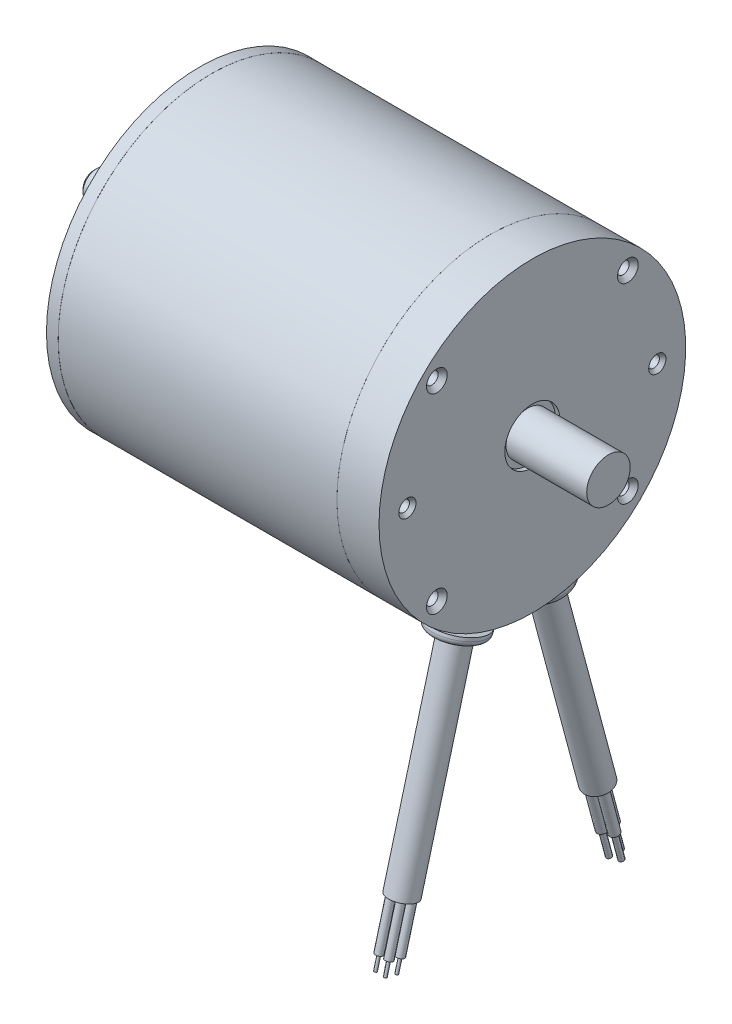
SolidWorks part; units mm, degrees
ref_plane "Front Plane" through (0, 0, 0) normal (0, 0, 1) x (1, 0, 0)
ref_plane "Top Plane" through (0, 0, 0) normal (0, 1, 0) x (1, 0, 0)
ref_plane "Right Plane" through (0, 0, 0) normal (1, 0, 0) x (0, 0, -1)
sketch "Sketch1" plane through (0, 0, 0) normal (0, 0, 1) x (1, 0, 0)
  line L0 (0, 0) -> (138.9109, 0) construction
  line L1 (0, 0) -> (0, 2.5)
  line L2 (0, 2.5) -> (21.12, 2.5)
  line L3 (21.12, 2.5) -> (21.12, 11.006)
  line L4 (21.12, 11.006) -> (20.92, 11.006)
  line L5 (20.92, 11.006) -> (20.92, 9.4)
  line L6 (20.92, 9.4) -> (17.5, 9.4)
  line L7 (17.5, 9.4) -> (17.5, 12.5)
  line L8 (17.5, 12.5) -> (19.5, 12.5)
  line L9 (19.5, 12.5) -> (19.5, 28.22)
  line L10 (19.5, 28.22) -> (80.7, 28.22)
  line L11 (80.7, 28.22) -> (80.7, 5.08)
  line L12 (80.7, 5.08) -> (79.86, 5.08)
  line L13 (79.86, 5.08) -> (79.86, 4)
  line L14 (94.7, 0) -> (0, 0)
  line L15 (79.86, 4) -> (94.7, 4)
  line L16 (94.7, 4) -> (94.7, 0)
  dimension "D2" = 25
  dimension "D3" = 18.8
  dimension "D4" = 2
  dimension "D5" = 22.012
  dimension "D6" = 5
  dimension "D7" = 21.12
  dimension "D8" = 56.44
  dimension "D9" = 19.5
  dimension "D11" = 0.2
  dimension "LENGTH" = 61.2
  dimension "D12" = 8
  dimension "D13" = 14
  dimension "D14" = 10.16
  dimension "D15" = 14.84
revolve "Revolve1" add sketch "Sketch1" angle 360 about L0
chamfer "Chamfer1" distance 0.508 angle 45 1 edges at (0, 0, 2.5)
fillet "Fillet1" radius 0.25 1 edges at (17.5, 0, 12.5)
fillet "Fillet2" radius 0.13 1 edges at (17.5, 0, 9.4)
sketch "Sketch2" plane through (0, 0, 0) normal (0, 0, 1) x (1, 0, 0)
  line L0 (80.7, 28.22) -> (19.5, 28.22) construction
  line L2 (72.9465, 28.22) -> (72.9535, 28.22)
  line L3 (19.5, 28.22) -> (19.5, -28.22) construction
  line L4 (21.6638, 28.22) -> (21.66, 28.2138)
  line L5 (21.66, 28.2138) -> (21.6568, 28.22)
  line L6 (72.9535, 28.22) -> (72.95, 28.2139)
  line L7 (72.95, 28.2139) -> (72.9465, 28.22)
  line L8 (21.6638, 28.22) -> (21.6568, 28.22)
  line L9 (80.7, -28.22) -> (80.7, 28.22) construction
  dimension "D1" = 0.007
  dimension "D2" = 2.16
  dimension "D3" = 28.2138
  dimension "D4" = 0.007
  dimension "D5" = 7.75
revolve "Cut-Revolve1" cut sketch "Sketch2" angle 360 about axis through (0, 0, 0) along (-1, 0, 0)
sketch "Sketch25" plane through (0, 0, 0) normal (0, 0, 1) x (1, 0, 0)
  line L0 (21.12, 11.006) -> (21.12, -11.006) construction
  line L1 (21.12, 6.5772) -> (21.12, 5.8868)
  line L2 (20.92, 9.3646) -> (21.4467, 9.3646)
  line L3 (20.92, -11.006) -> (20.92, 11.006) construction
  line L4 (21.4467, 9.3646) -> (21.4467, 6.904)
  line L5 (21.4467, 6.904) -> (21.12, 6.5772)
  line L6 (21.12, 5.8868) -> (21.4467, 5.56)
  line L7 (21.4467, 5.56) -> (21.4467, 2.7378)
  line L8 (20.92, 2.5) -> (22.9293, 2.5) construction
  line L9 (21.12, 2.5) -> (0.508, 2.5) construction
  line L10 (21.4467, 2.7378) -> (22.7362, 2.7378)
  line L11 (22.7362, 2.7378) -> (22.7362, 2.5)
  line L12 (22.7362, 2.5) -> (20.92, 2.5)
  line L13 (20.92, 2.5) -> (20.92, 9.3646)
  dimension "D1" = 2.7378
  dimension "D2" = 6.8646
  dimension "D3" = 0.5267
  dimension "D4" = 1.2895
  dimension "D5" = 3.149
  dimension "D6" = 45
  dimension "D7" = 2.7874
  dimension "D8" = 45
revolve "Cut-Revolve2" cut sketch "Sketch25" angle 360 about axis through (0, 0, 0) along (-1, 0, 0)
sketch "Sketch10" plane through (80.7, 0, 0) normal (1, 0, 0) x (0, 0, -1)
  line L0 (0, 0) -> (-23, 0) construction
  line L1 (0, 0) -> (-17.5751, 17.5751) construction
  circle A0 centre (0, 0) radius 24.855 construction
  circle A1 centre (0, 0) radius 23 construction
  dimension "D1" = 49.71
  dimension "D2" = 46
  dimension "D3" = 45
hole_wizard "#4-40 Tapped Hole2" positions "Sketch12" profile "Sketch11" tap size "#4-40" standard "Ansi Inch"
sketch "Sketch12" plane through (80.7, 0, 0) normal (1, 0, 0) x (0, 0, -1)
  point P0 (-17.5751, 17.5751)
sketch "Sketch11" plane through (80.7, 17.5751, 17.5751) normal (0, 1, 0) x (0, 0, -1)
  line L0 (0, 0) -> (0, 8.2742)
  line L1 (0, 8.2742) -> (1.1303, 7.595)
  line L2 (1.1303, 7.595) -> (1.1303, 0.8912)
  line L3 (1.1303, 0.8912) -> (1.905, 0)
  line L5 (1.905, 0) -> (0, 0)
  line L6 (-1.1303, 0.8912) -> (-1.905, 0) construction
  line L10 (0, 8.2742) -> (-1.1303, 7.595) construction
  line L11 (0, -6.35) -> (0, 107.95) construction
  dimension "Tap Drill Dia." = 2.2606
  dimension "Tap Drill Depth" = 7.595
  dimension "Near C'Sink Dia." = 3.81
  dimension "Near C'Sink Angle" = 82
  dimension "Drill Angle" = 118
hole_wizard "M2.5x0.45 Tapped Hole2" positions "Sketch16" profile "Sketch15" tap size "M2.5x0.45" standard "Ansi Metric"
sketch "Sketch16" plane through (80.7, 0, 0) normal (1, 0, 0) x (0, 0, -1)
  point P0 (-23, 0)
sketch "Sketch15" plane through (80.7, 0, 23) normal (0, 1, 0) x (0, 0, -1)
  line L0 (0, 0) -> (0, 6.9659)
  line L1 (0, 6.9659) -> (1.025, 6.35)
  line L2 (1.025, 6.35) -> (1.025, 0.65)
  line L3 (1.025, 0.65) -> (1.59, 0)
  line L5 (1.59, 0) -> (0, 0)
  line L6 (-1.025, 0.65) -> (-1.59, 0) construction
  line L10 (0, 6.9659) -> (-1.025, 6.35) construction
  line L11 (0, -6.35) -> (0, 107.95) construction
  dimension "Tap Drill Dia." = 2.05
  dimension "Tap Drill Depth" = 6.35
  dimension "Near C'Sink Dia." = 3.18
  dimension "Near C'Sink Angle" = 82
  dimension "Drill Angle" = 118
pattern_circular "CirPattern2" count 2 over 360 about axis through (0, 0, 0) along (1, 0, 0) of "M2.5x0.45 Tapped Hole2"
pattern_circular "CirPattern3" count 4 over 360 about axis through (0, 0, 0) along (1, 0, 0) of "#4-40 Tapped Hole2"
sketch "Sketch17" plane through (19.5, 0, 0) normal (-1, 0, 0) x (0, 0, 1)
  line L0 (0, 0) -> (0, 24.855) construction
  line L1 (0, 0) -> (17.5751, 17.5751) construction
  circle A0 centre (0, 0) radius 24.855 construction
  circle A1 centre (0, 0) radius 21 construction
  circle A2 centre (17.5751, 17.5751) radius 1.875
  dimension "D1" = 49.71
  dimension "D2" = 42
  dimension "D4" = 3.75
  dimension "D3" = 45
hole_wizard "M4x0.7 Tapped Hole1" positions "Sketch19" profile "Sketch18" tap size "M4x0.7" standard "Ansi Metric"
sketch "Sketch19" plane through (19.5, 0, 0) normal (-1, 0, 0) x (0, 0, 1)
  line L0 (0, 0) -> (0, 24.855) construction
  circle A0 centre (0, 0) radius 21 construction
  point P0 (0, 21)
sketch "Sketch18" plane through (19.5, 21, 0) normal (0, 1, 0) x (0, 0, 1)
  line L0 (0, 0) -> (0, 11.0914)
  line L1 (0, 11.0914) -> (1.65, 10.1)
  line L2 (1.65, 10.1) -> (1.65, 0.4314)
  line L3 (1.65, 0.4314) -> (2.025, 0)
  line L5 (2.025, 0) -> (0, 0)
  line L6 (-1.65, 0.4314) -> (-2.025, 0) construction
  line L10 (0, 11.0914) -> (-1.65, 10.1) construction
  line L11 (0, -6.35) -> (0, 107.95) construction
  dimension "Tap Drill Dia." = 3.3
  dimension "Tap Drill Depth" = 10.1
  dimension "Near C'Sink Dia." = 4.05
  dimension "Near C'Sink Angle" = 82
  dimension "Drill Angle" = 118
pattern_circular "CirPattern4" count 4 over 360 about axis through (0, 0, 0) along (1, 0, 0) of "M4x0.7 Tapped Hole1"
sketch "Sketch22" plane through (19.5, 0, 0) normal (-1, 0, 0) x (0, 0, 1)
  line L0 (0, 0) -> (0, 24.855) construction
  line L1 (0, 0) -> (17.5751, 17.5751) construction
  circle A0 centre (0, 0) radius 24.855 construction
  circle A1 centre (17.5751, 17.5751) radius 3.175
  dimension "D1" = 49.71
  dimension "D3" = 6.35
  dimension "D2" = 45
extrude "Cut-Extrude2" cut sketch "Sketch22" against normal blind 0.75
sketch "Sketch23" plane through (20.25, 0, 0) normal (-1, 0, 0) x (0, 0, 1)
  line L0 (17.5751, 17.5751) -> (15.3301, 19.8202) construction
  line L1 (17.5751, 17.5751) -> (17.5751, 20.7501) construction
  line L2 (17.5751, 17.5751) -> (19.8202, 19.8202) construction
  line L3 (17.5751, 17.5751) -> (20.7501, 17.5751) construction
  line L4 (17.5751, 17.5751) -> (14.4001, 17.5751) construction
  line L5 (17.5751, 17.5751) -> (15.3301, 15.3301) construction
  line L6 (17.5751, 17.5751) -> (17.5751, 14.4001) construction
  line L7 (17.5751, 17.5751) -> (19.8202, 15.3301) construction
  line L8 (17.0642, 18.6517) -> (16.6054, 19.1106)
  line L9 (18.6517, 18.086) -> (19.1106, 18.5449)
  line L10 (18.086, 16.4985) -> (18.5449, 16.0397)
  line L11 (16.4985, 17.0642) -> (16.0397, 16.6054)
  line L12 (16.4985, 18.086) -> (16.0397, 18.5449)
  line L13 (18.086, 18.6517) -> (18.5449, 19.1106)
  line L14 (18.6517, 17.0642) -> (19.1106, 16.6054)
  line L15 (17.0642, 16.4985) -> (16.6054, 16.0397)
  line L16 (17.5751, 15.9876) -> (17.444, 16.6982)
  line L17 (17.858, 17.858) -> (15.6129, 20.103) construction
  line L18 (17.2923, 17.2923) -> (15.0472, 19.5374) construction
  line L19 (17.2923, 17.858) -> (15.0472, 15.6129) construction
  line L20 (17.858, 17.2923) -> (15.6129, 15.0472) construction
  line L21 (17.2923, 17.2923) -> (19.5374, 15.0472) construction
  line L22 (17.858, 17.858) -> (20.103, 15.6129) construction
  line L23 (17.858, 17.2923) -> (20.103, 19.5374) construction
  line L24 (17.2923, 17.858) -> (19.5374, 20.103) construction
  line L25 (17.5751, 15.9876) -> (17.7063, 16.6982)
  line L26 (15.9876, 17.5751) -> (16.6992, 17.7006)
  line L27 (17.5751, 19.1626) -> (17.444, 18.4521)
  line L28 (17.5751, 19.1626) -> (17.7063, 18.4521)
  line L29 (15.9876, 17.5751) -> (16.6992, 17.4497)
  line L30 (19.1626, 17.5751) -> (18.4511, 17.7006)
  line L31 (19.1626, 17.5751) -> (18.4511, 17.4497)
  circle A0 centre (17.5751, 17.5751) radius 3.175 construction
  circle A1 centre (17.5751, 17.5751) radius 3.175 construction
  arc A2 (16.6054, 19.1106) -> (16.0397, 18.5449) centre (17.5751, 17.5751) ccw
  arc A3 (16.0397, 16.6054) -> (16.6054, 16.0397) centre (17.5751, 17.5751) ccw
  arc A4 (18.5449, 16.0397) -> (19.1106, 16.6054) centre (17.5751, 17.5751) ccw
  arc A5 (19.1106, 18.5449) -> (18.5449, 19.1106) centre (17.5751, 17.5751) ccw
  arc A6 (18.086, 16.4985) -> (17.7063, 16.6982) centre (17.5751, 15.9876) ccw
  arc A7 (16.4985, 17.0642) -> (16.6992, 17.4497) centre (15.9876, 17.5751) ccw
  arc A8 (17.0642, 18.6517) -> (17.444, 18.4521) centre (17.5751, 19.1626) ccw
  arc A9 (18.6517, 18.086) -> (18.4511, 17.7006) centre (19.1626, 17.5751) ccw
  arc A10 (17.7063, 18.4521) -> (18.086, 18.6517) centre (17.5751, 19.1626) ccw
  arc A11 (18.4511, 17.4497) -> (18.6517, 17.0642) centre (19.1626, 17.5751) ccw
  arc A12 (17.444, 16.6982) -> (17.0642, 16.4985) centre (17.5751, 15.9876) ccw
  arc A13 (16.6992, 17.7006) -> (16.4985, 18.086) centre (15.9876, 17.5751) ccw
  dimension "D5" = 3.632
  dimension "D1" = 10
  dimension "D2" = 10
  dimension "D3" = 10.457
  dimension "D4" = 10.457
  dimension "D6" = 10
  dimension "D7" = 10.457
  dimension "D8" = 45
  dimension "D9" = 0.4
extrude "Cut-Extrude3" cut sketch "Sketch23" against normal blind 1.75
pattern_circular "CirPattern1" count 4 over 360 about axis through (0, 0, 0) along (1, 0, 0) of "Cut-Extrude3", "Cut-Extrude2"
sketch "Sketch26" plane through (0, 0, 0) normal (0, 1, 0) x (1, 0, 0)
  line L0 (21.4467, 2.7378) -> (21.12, 3.0645)
  line L1 (21.12, 11.006) -> (21.12, -11.006) construction
  line L2 (21.12, 3.0645) -> (21.12, 3.592)
  line L3 (21.12, 3.592) -> (21.4467, 3.9187)
  line L4 (21.4467, 9.3646) -> (21.4467, -9.3646) construction
  line L5 (21.4467, 3.9187) -> (21.4467, 2.7378)
  dimension "D1" = 45
  dimension "D2" = 1.1809
  dimension "D3" = 45
revolve "Revolve2" add sketch "Sketch26" angle 360 about axis through (0, 0, 0) along (-1, 0, 0)
ref_plane "Plane3" through (0, -27.2584, -7.3039) normal (0, -0.9659, -0.2588) x (1, 0, 0)
ref_plane "Plane4" through (0, -27.2584, 7.3039) normal (0, -0.9659, 0.2588) x (1, 0, 0)
sketch "Sketch28" plane through (0, -27.2584, 7.3039) normal (0, -0.9659, 0.2588) x (1, 0, 0)
  line L0 (94.7, 0) -> (0, 0) construction
  line L1 (94.7, -4) -> (94.7, 4) construction
  line L2 (74.7126, 28.22) -> (74.7126, -28.22) construction
  line L3 (80.7, 28.22) -> (72.9535, 28.22) construction
  line L4 (72.9535, -28.22) -> (80.7, -28.22) construction
  line L5 (80.7, -28.22) -> (80.7, 28.22) construction
  circle A0 centre (74.7126, 0) radius 3.175
  dimension "D2" = 6.35
  dimension "D1" = 5.9874
extrude "Boss-Extrude3" add sketch "Sketch28" along normal mid plane 3
sketch "Sketch29" plane through (0, -28.7073, 7.6921) normal (0, -0.9659, 0.2588) x (1, 0, 0)
  circle A0 centre (74.7126, 0) radius 4.7625
  dimension "D1" = 9.525
extrude "Boss-Extrude4" add sketch "Sketch29" along normal blind 1.588
sketch "Sketch30" plane through (0, -30.2412, 8.1031) normal (0, -0.9659, 0.2588) x (1, 0, 0)
  circle A0 centre (74.7126, 0) radius 2.54
  dimension "D1" = 5.08
extrude "Boss-Extrude5" add sketch "Sketch30" along normal blind 38.291
fillet "Fillet4" radius 1 1 edges at (74.7126, -31.4738, 3.5029)
sketch "Sketch31" plane through (0, -67.2275, 18.0135) normal (0, -0.9659, 0.2588) x (1, 0, 0)
  circle A0 centre (74.7126, 0) radius 2.15
  dimension "D1" = 4.3
extrude "Cut-Extrude4" cut sketch "Sketch31" against normal blind 38.291
pattern_circular "CirPattern7" count 2 over 330 about axis through (0, 0, 0) along (-1, 0, 0) of "Cut-Extrude4", "Fillet4", "Boss-Extrude5", "Boss-Extrude4", "Boss-Extrude3"
sketch "Sketch32" plane through (0, -30.2412, -8.1031) normal (0, -0.9659, -0.2588) x (1, 0, 0)
  line L1 (74.7126, 0) -> (74.7126, 6.0964) construction
  line L2 (74.4058, -1.027) -> (74.7126, 0) construction
  line L3 (74.7126, 0) -> (73.9765, 0.7792) construction
  line L4 (74.7126, 0) -> (75.7554, 0.2478) construction
  circle A0 centre (73.9765, 0.7792) radius 0.889
  circle A1 centre (74.4058, -1.027) radius 0.889
  circle A2 centre (75.7554, 0.2478) radius 0.889
  circle A3 centre (74.7126, 0) radius 1.0719 construction
  circle A6 centre (74.7126, 0) radius 2.15 construction
  dimension "D1" = 2.1438
  dimension "D5" = 1.778
  dimension "D2" = 43.369
  dimension "D3" = 120
  dimension "D4" = 120
extrude "Boss-Extrude6" add sketch "Sketch32" along normal blind 47
sketch "Sketch33" plane through (0, -30.2412, 8.1031) normal (0, -0.9659, 0.2588) x (1, 0, 0)
  circle A0 centre (74.7126, 0) radius 0.6985
  circle A1 centre (73.8042, 1.092) radius 0.6985
  circle A2 centre (75.6158, 1.092) radius 0.6985
  circle A3 centre (75.6158, -1.0887) radius 0.6985
  circle A4 centre (73.8042, -1.0887) radius 0.6985
  dimension "D1" = 1.397
  dimension "D2" = 1.0887
  dimension "D3" = 0.9083
  dimension "D4" = 0.9032
  dimension "D5" = 1.0887
  dimension "D6" = 0.9083
  dimension "D7" = 1.092
  dimension "D8" = 0.9032
  dimension "D9" = 1.092
extrude "Boss-Extrude7" add sketch "Sketch33" along normal blind 47
sketch "Sketch34" plane through (0, -75.6397, -20.2676) normal (0, -0.9659, -0.2588) x (1, 0, 0)
  circle A0 centre (75.7554, 0.2478) radius 0.4825
  circle A1 centre (73.9765, 0.7792) radius 0.4825
  circle A2 centre (74.4058, -1.027) radius 0.4825
  dimension "D1" = 0.965
extrude "Boss-Extrude8" add sketch "Sketch34" along normal blind 5.08
sketch "Sketch35" plane through (0, -75.6397, 20.2676) normal (0, -0.9659, 0.2588) x (1, 0, 0)
  circle A0 centre (75.6158, -1.0887) radius 0.254
  circle A1 centre (73.8042, -1.0887) radius 0.254
  circle A2 centre (74.7126, 0) radius 0.254
  circle A3 centre (73.8042, 1.092) radius 0.254
  circle A4 centre (75.6158, 1.092) radius 0.254
  dimension "D1" = 0.508
extrude "Boss-Extrude9" add sketch "Sketch35" along normal blind 2.54
